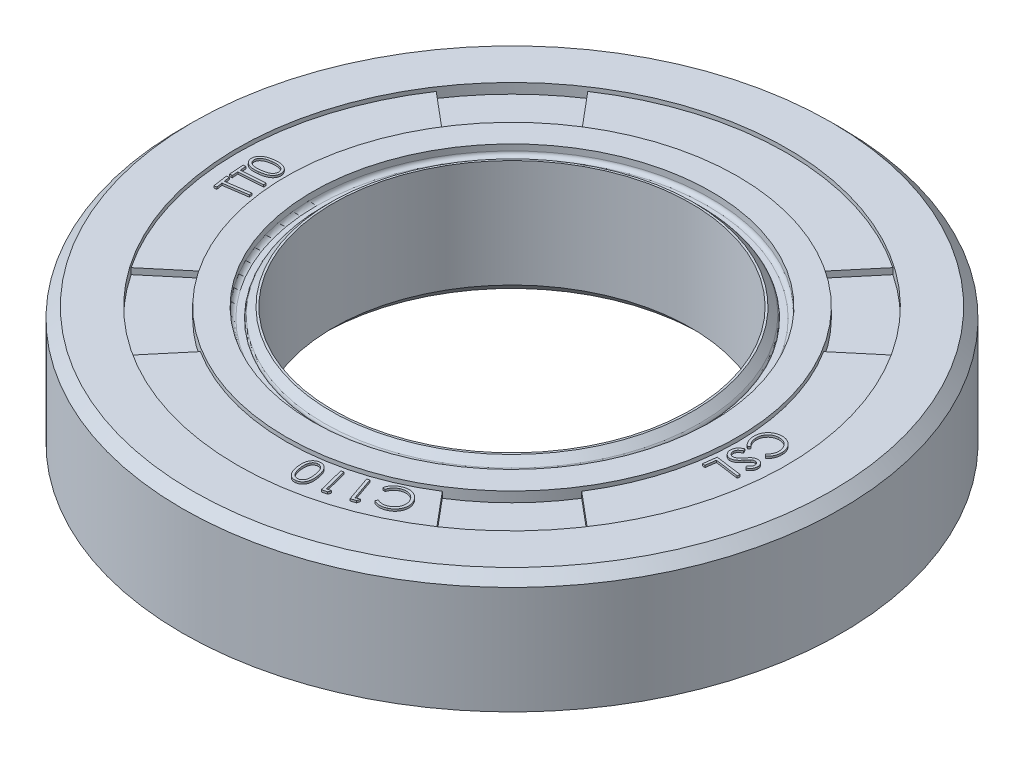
SolidWorks part; units mm, degrees
ref_plane "Front Plane" through (0, 0, 0) normal (0, 0, 1) x (1, 0, 0)
ref_plane "Top Plane" through (0, 0, 0) normal (0, 1, 0) x (1, 0, 0)
ref_plane "Right Plane" through (0, 0, 0) normal (1, 0, 0) x (0, 0, -1)
sketch "Sketch1" plane through (0, 0, 0) normal (0, 1, 0) x (1, 0, 0)
  circle A0 centre (0, 0) radius 16.2
  dimension "D1" = 32.4
extrude "Extrude1" add sketch "Sketch1" along normal blind 5.8
sketch "Sketch2" plane through (0, 5.8, 0) normal (0, 1, 0) x (1, 0, 0)
  circle A0 centre (0, 0) radius 8.8
  dimension "D1" = 17.6
extrude "Extrude2" cut sketch "Sketch2" against normal through all
sketch "Sketch3" plane through (0, 0, 0) normal (0, -1, 0) x (1, 0, 0)
  circle A0 centre (0, 0) radius 11.6
  circle A1 centre (0, 0) radius 15.1
  circle A2 centre (0, 0) radius 8.8 construction
  dimension "D1" = 2.8
  dimension "D2" = 3.5
extrude "Extrude3" cut sketch "Sketch3" against normal blind 4.3
sketch "Sketch4" plane through (0, 4.3, 0) normal (0, -1, 0) x (1, 0, 0)
  line L0 (-4, 14.5606) -> (-2.1722, 11.3948)
  line L1 (4, 14.5606) -> (2.1722, 11.3948)
  line L2 (0, 0) -> (0, 15.1) construction
  circle A0 centre (0, 0) radius 15.1 construction
  circle A1 centre (0, 0) radius 11.6 construction
  arc A2 (2.1722, 11.3948) -> (-2.1722, 11.3948) centre (0, 0) ccw
  arc A3 (4, 14.5606) -> (-4, 14.5606) centre (0, 0) ccw
  dimension "D1" = 60
  dimension "D2" = 8
extrude "Extrude4" cut sketch "Sketch4" against normal blind 0.5
pattern_circular "CirPattern1" count 6 over 360 about axis through (0, 0, 0) along (0, 1, 0) of "Extrude4"
sketch "Sketch5" plane through (0, 5.8, 0) normal (0, 1, 0) x (1, 0, 0)
  circle A0 centre (0, 0) radius 9.3
  circle A1 centre (0, 0) radius 9.8
  circle A2 centre (0, 0) radius 11.1
  circle A3 centre (0, 0) radius 13.5
  circle A4 centre (0, 0) radius 8.8 construction
  dimension "D1" = 0.5
  dimension "D2" = 0.5
  dimension "D3" = 1.3
  dimension "D4" = 2.4
extrude "Extrude5" cut sketch "Sketch5" against normal blind 0.5 contours A1 A0 | A3 A2
chamfer "Chamfer1" distance 0.4 angle 45 1 edges at (0, 5.8, 9.3)
fillet "Fillet1" radius 0.2 2 edges at (0, 5.3, 9.8) (0, 5.4, 9.3)
chamfer "Chamfer2" distance 0.5 angle 45 1 edges at (0, 5.8, 16.2)
chamfer "Chamfer3" distance 0.5 angle 45 1 edges at (0, 0, 8.8)
sketch "Sketch6" plane through (0, 5.3, 0) normal (0, 1, 0) x (1, 0, 0)
  line L0 (-7.5, 11.225) -> (-5.9461, 9.3731)
  line L1 (5.9461, 9.3731) -> (7.5, 11.225)
  line L2 (0, 0) -> (0, 13.5) construction
  circle A0 centre (0, 0) radius 13.5 construction
  circle A1 centre (0, 0) radius 11.1 construction
  circle A2 centre (0, 0) radius 11.1 construction
  arc A3 (5.9461, 9.3731) -> (-5.9461, 9.3731) centre (0, 0) ccw
  arc A4 (7.5, 11.225) -> (-7.5, 11.225) centre (0, 0) ccw
  dimension "D1" = 80
  dimension "D2" = 15
extrude "Extrude6" add sketch "Sketch6" along normal blind 0.3
pattern_circular "CirPattern2" count 4 over 360 about axis through (0, 0, 0) along (0, 1, 0) of "Extrude6"
sketch "Sketch7" plane through (0, 5.6, 0) normal (0, 1, 0) x (-1, 0, 0)
  circle A0 centre (0, 0) radius 11.4277 construction
  text T0 "                                                                    CSL                    C110                                  TT0" font "Century Gothic" height in points 5
extrude "Extrude11" add sketch "Sketch7" along normal blind 0.1
